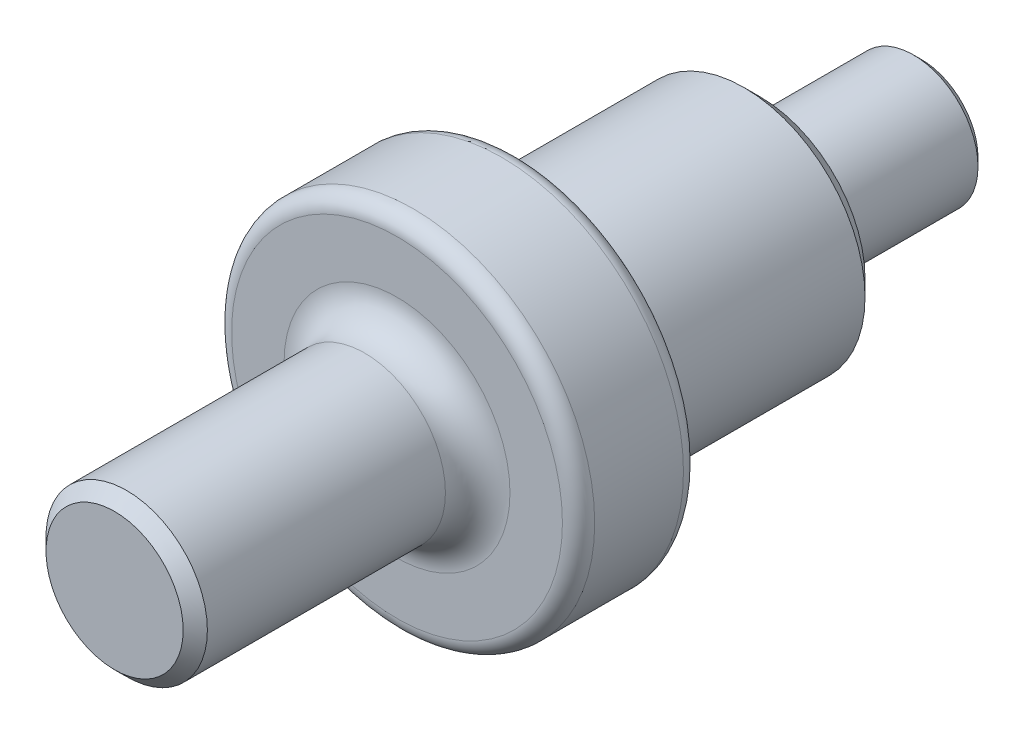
SolidWorks part; units mm, degrees
ref_plane "Plano frontal" through (0, 0, 0) normal (0, 0, 1) x (1, 0, 0)
ref_plane "Plano superior" through (0, 0, 0) normal (0, 1, 0) x (1, 0, 0)
ref_plane "Plano direito" through (0, 0, 0) normal (1, 0, 0) x (0, 0, -1)
sketch "Esboço1" plane through (0, 0, 0) normal (0, 0, 1) x (1, 0, 0)
  circle A0 centre (0, 0) radius 8
  dimension "D1" = 16
extrude "Ressalto-extrusão1" add sketch "Esboço1" along normal blind 20
sketch "Esboço2" plane through (0, 0, 20) normal (0, 0, 1) x (1, 0, 0)
  circle A0 centre (0, 0) radius 15
  dimension "D1" = 30
extrude "Ressalto-extrusão2" add sketch "Esboço2" along normal blind 30
sketch "Esboço3" plane through (0, 0, 50) normal (0, 0, 1) x (1, 0, 0)
  circle A0 centre (0, 0) radius 22.5
  dimension "D1" = 45
extrude "Ressalto-extrusão3" add sketch "Esboço3" along normal blind 15
sketch "Esboço4" plane through (0, 0, 65) normal (0, 0, 1) x (1, 0, 0)
  circle A0 centre (0, 0) radius 10
  dimension "D1" = 20
extrude "Ressalto-extrusão4" add sketch "Esboço4" along normal blind 35
chamfer "Chanfro1" distance 1 angle 45 1 edges at (8, 0, 0)
chamfer "Chanfro2" distance 2 angle 45 1 edges at (15, 0, 20)
chamfer "Chanfro3" distance 1.5 angle 45 1 edges at (10, 0, 100)
fillet "Filete1" radius 2 1 edges at (22.5, 0, 50)
fillet "Filete2" radius 2 1 edges at (22.5, 0, 65)
fillet "Filete3" radius 4 1 edges at (10, 0, 65)
